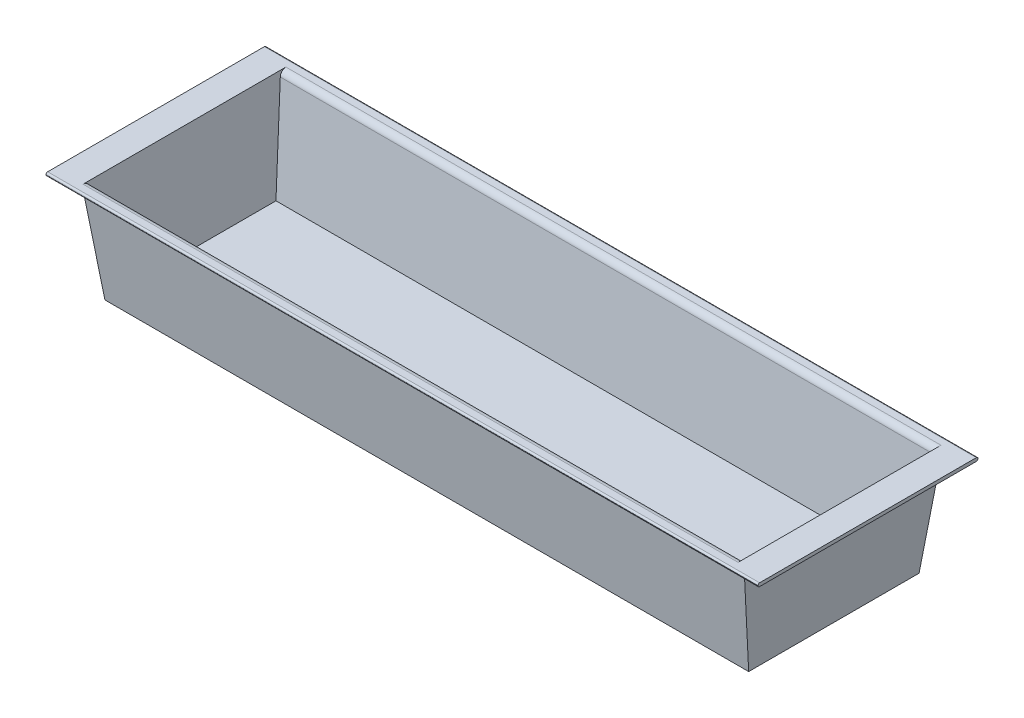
SolidWorks part; units mm, degrees
ref_plane "Plan de face" through (0, 0, 0) normal (0, 0, 1) x (1, 0, 0)
ref_plane "Plan de dessus" through (0, 0, 0) normal (0, 1, 0) x (1, 0, 0)
ref_plane "Plan de droite" through (0, 0, 0) normal (1, 0, 0) x (0, 0, -1)
sketch "Esquisse1" plane through (0, 0, 0) normal (0, 1, 0) x (1, 0, 0)
  line L1 (-175, -52.5) -> (175, -52.5)
  line L2 (-175, -52.5) -> (-175, 52.5)
  line L3 (-175, 52.5) -> (175, 52.5)
  line L4 (175, -52.5) -> (175, 52.5)
  line L5 (-175, -52.5) -> (175, 52.5) construction
  line L6 (-175, 52.5) -> (175, -52.5) construction
  point P0 (0, 0)
  dimension "D1" = 105
  dimension "D2" = 350
ref_plane "Plan1" through (0, -55.75, 0) normal (0, 1, 0) x (1, 0, 0)
sketch "Esquisse2" plane through (0, -55.75, 0) normal (0, 1, 0) x (1, 0, 0)
  line L1 (-170, 45) -> (170, 45)
  line L2 (-170, 45) -> (-170, -45)
  line L3 (-170, -45) -> (170, -45)
  line L4 (170, 45) -> (170, -45)
  line L5 (-170, 45) -> (170, -45) construction
  line L6 (-170, -45) -> (170, 45) construction
  point P0 (0, 0)
  dimension "D1" = 340
  dimension "D2" = 90
loft "Lissage1" add profiles "Esquisse2", "Esquisse1"
shell "Coque1" thickness 2
sketch "Esquisse3" plane through (0, 0, 0) normal (0, 1, 0) x (1, 0, 0)
  line L1 (-188, -58.125) -> (188, -58.125)
  line L2 (-188, -58.125) -> (-188, 58.125)
  line L3 (-188, 58.125) -> (188, 58.125)
  line L4 (188, -58.125) -> (188, 58.125)
  line L5 (-188, -58.125) -> (188, 58.125) construction
  line L6 (-188, 58.125) -> (188, -58.125) construction
  line L11 (172.992, -50.7342) -> (172.992, 50.7342)
  line L12 (-172.992, -50.7342) -> (172.992, -50.7342)
  line L13 (-172.992, 50.7342) -> (-172.992, -50.7342)
  line L14 (172.992, 50.7342) -> (-172.992, 50.7342)
  line L15 (172.992, -50.7342) -> (172.992, 50.7342)
  line L16 (-172.992, -50.7342) -> (172.992, -50.7342)
  line L17 (-172.992, 50.7342) -> (-172.992, -50.7342)
  line L18 (172.992, 50.7342) -> (-172.992, 50.7342)
  point P0 (0, 0)
  dimension "D1" = 376
  dimension "D2" = 116.25
  dimension "D3" = 0
extrude "Boss.-Extru.1" add sketch "Esquisse3" against normal blind 1.75
fillet "Congé1" radius 0.875 4 edges at (0, -1.75, 58.125) (0, 0, 58.125) (0, -1.75, -58.125) (0, 0, -58.125)
fillet "Congé2" radius 1.5 2 edges at (0, -1.75, -52.2646) (0, -1.75, 52.2646)
fillet "Congé3" radius 3.25 2 edges at (0, 0, -50.7342) (0, 0, 50.7342)
